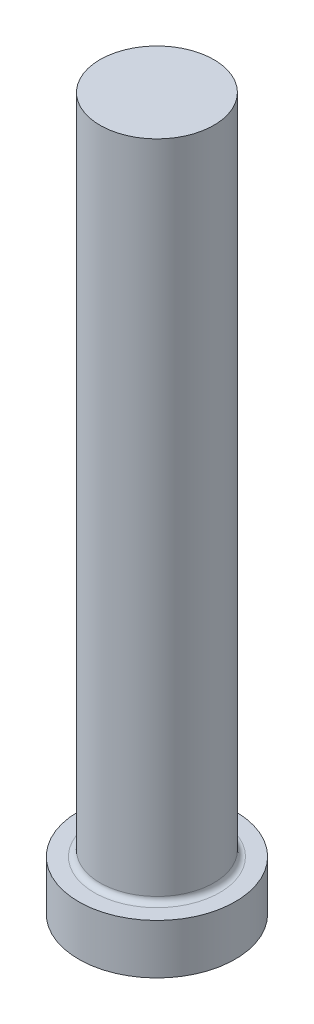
SolidWorks part; units mm, degrees
ref_plane "Plano frontal" through (0, 0, 0) normal (0, 0, 1) x (1, 0, 0)
ref_plane "Plano superior" through (0, 0, 0) normal (0, 1, 0) x (1, 0, 0)
ref_plane "Plano direito" through (0, 0, 0) normal (1, 0, 0) x (0, 0, -1)
sketch "Esboço1" plane through (0, 0, 0) normal (0, 0, 1) x (1, 0, 0)
  line L0 (0, 0) -> (11, 0)
  line L1 (11, 0) -> (11, 7)
  line L2 (11, 7) -> (8.8, 7)
  line L3 (8, 7.8) -> (8, 100)
  line L4 (8, 100) -> (0, 100)
  line L5 (0, 100) -> (0, 0) construction
  line L6 (0, 0) -> (0, 100)
  arc A0 (8.8, 7) -> (8, 7.8) centre (8.8, 7.8) cw
  dimension "D3" = 0.8
  dimension "D1" = 22
  dimension "D2" = 16
  dimension "D4" = 7
  dimension "D5" = 100
revolve "Revolução1" add sketch "Esboço1" angle 360 about L5
sketch "Esboço2"
  dimension "D1" = 0.825
  dimension "D2" = 1.925
  dimension "D3" = 1.2375
  dimension "D4" = 5.9125
wrap "Envolver1" sketch "Esboço2" wrap type deboss source sketch "Esboço2" thickness 0.1 parameters "D1"=0.1
